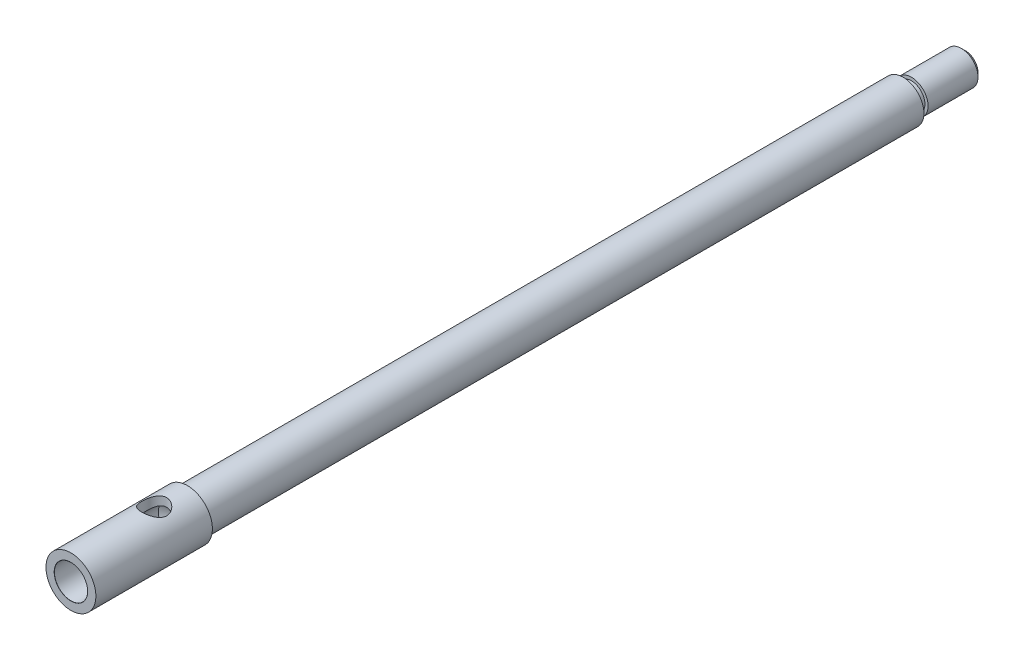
SolidWorks part; units mm, degrees
ref_plane "前视基准面" through (0, 0, 0) normal (0, 0, 1) x (1, 0, 0)
ref_plane "上视基准面" through (0, 0, 0) normal (0, 1, 0) x (1, 0, 0)
ref_plane "右视基准面" through (0, 0, 0) normal (1, 0, 0) x (0, 0, -1)
sketch "草图1" plane through (0, 0, 0) normal (0, 0, 1) x (1, 0, 0)
  circle A0 centre (0, 0) radius 4
  dimension "D1" = 8
extrude "凸台-拉伸1" add sketch "草图1" along normal blind 13
sketch "草图2" plane through (0, 0, 13) normal (0, 0, 1) x (1, 0, 0)
  circle A0 centre (0, 0) radius 3.25
  dimension "D1" = 6.5
extrude "凸台-拉伸2" add sketch "草图2" along normal blind 2
sketch "草图3" plane through (0, 0, 15) normal (0, 0, 1) x (1, 0, 0)
  circle A0 centre (0, 0) radius 5
  dimension "D1" = 10
extrude "凸台-拉伸4" add sketch "草图3" along normal blind 172
sketch "草图4" plane through (0, 0, 187) normal (0, 0, 1) x (1, 0, 0)
  circle A0 centre (0, 0) radius 6
  dimension "D1" = 12
extrude "凸台-拉伸5" add sketch "草图4" along normal blind 28
chamfer "倒角1" distance 1 1 edges at (4, 0, 0)
sketch "草图7" plane through (0, 0, 215) normal (0, 0, 1) x (1, 0, 0)
  point P0 (0, 0)
sketch "草图10" plane through (0, 0, 215) normal (0, 0, 1) x (1, 0, 0)
  point P0 (0, 0)
hole_wizard "Ø8.0mm 暗销孔2" positions "草图10" profile "草图9" hole size "Ø8.0" standard "GB"
sketch "草图9" plane through (0, 0, 215) normal (1, 0, 0) x (0, -1, 0)
  line L0 (0, 0) -> (0, 27.4034)
  line L1 (0, 27.4034) -> (4, 25)
  line L2 (4, 25) -> (4, 0.025)
  line L3 (4, 0.025) -> (4.025, 0)
  line L5 (4.025, 0) -> (0, 0)
  line L6 (-4, 0.025) -> (-4.025, 0) construction
  line L10 (0, 27.4034) -> (-4, 25) construction
  line L11 (0, -6.35) -> (0, 107.95) construction
  dimension "孔直径" = 8
  dimension "孔深度" = 25
  dimension "近端锥形沉头孔直径" = 8.05
  dimension "近端锥形沉头孔角度" = 90
  dimension "导头角度" = 118
sketch "草图13" plane through (0, 0, 0) normal (0, 1, 0) x (1, 0, 0)
  line L0 (-6, -215) -> (6, -215) construction
  point P0 (0, -195)
  dimension "D1" = 20
sketch "草图16" plane through (0, 0, 0) normal (0, 1, 0) x (1, 0, 0)
  line L0 (-6, -215) -> (6, -215) construction
  point P0 (0, -195)
  dimension "D1" = 20
hole_wizard "Ø6.0mm 暗销孔2" positions "草图16" profile "草图15" hole size "Ø6.0" standard "GB"
sketch "草图15" plane through (0, 0, 195) normal (1, 0, 0) x (0, 0, -1)
  line L0 (0, 0) -> (0, 6)
  line L1 (0, 6) -> (3, 6)
  line L2 (3, 6) -> (3, 0.025)
  line L3 (3, 0.025) -> (3.025, 0)
  line L5 (3.025, 0) -> (0, 0)
  line L6 (-3, 0.025) -> (-3.025, 0) construction
  line L11 (0, -6.35) -> (0, 107.95) construction
  dimension "通孔孔直径" = 6
  dimension "通孔孔深度" = 6
  dimension "近端锥形沉头孔直径" = 6.05
  dimension "近端锥形沉头孔角度" = 90
mirror "镜向1" about plane through (0, 0, 0) normal (0, 1, 0) of "Ø6.0mm 暗销孔2"
